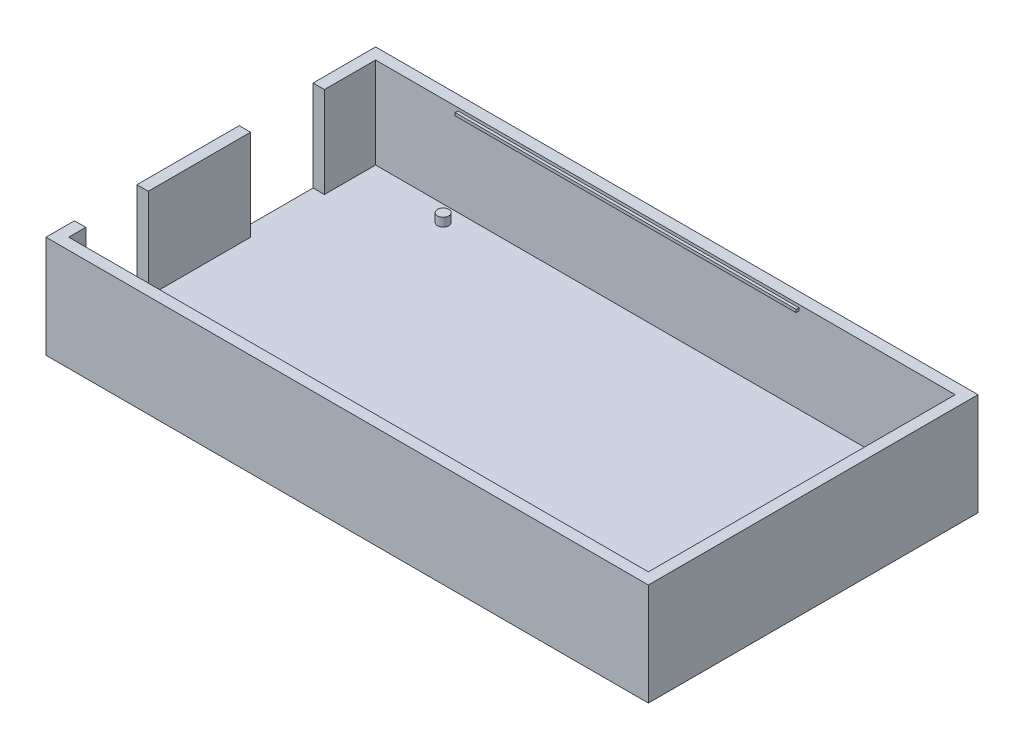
SolidWorks part; units mm, degrees
ref_plane "Alzado" through (0, 0, 0) normal (0, 0, 1) x (1, 0, 0)
ref_plane "Planta" through (0, 0, 0) normal (0, 1, 0) x (1, 0, 0)
ref_plane "Vista lateral" through (0, 0, 0) normal (1, 0, 0) x (0, 0, -1)
sketch "Croquis1" plane through (0, 0, 0) normal (0, 1, 0) x (1, 0, 0)
  line L1 (0, 0) -> (106, 0)
  line L2 (0, 0) -> (0, 58)
  line L3 (0, 58) -> (106, 58)
  line L4 (106, 0) -> (106, 58)
  dimension "D1" = 106
  dimension "D2" = 58
extrude "Saliente-Extruir1" add sketch "Croquis1" along normal blind 18
shell "Vaciado1" thickness 2
ref_plane "Plano1" through (0, 2, 0) normal (0, 1, 0) x (1, 0, 0)
ref_plane "Plano6" through (0, 0, 0) normal (-1, 0, 0) x (0, 0, 1)
sketch "Croquis9" plane through (0, 0, 0) normal (-1, 0, 0) x (0, 0, 1)
  line L0 (-47, 18) -> (-47, 2)
  line L1 (-58, 18) -> (0, 18) construction
  line L2 (29.7, 2) -> (-29.7, 2) construction
  line L3 (-47, 2) -> (-34, 2)
  line L4 (-34, 2) -> (-34, 18)
  line L5 (-34, 18) -> (-47, 18)
  line L6 (-16, 18) -> (-16, 2)
  line L7 (-16, 2) -> (-5, 2)
  line L8 (-5, 2) -> (-5, 18)
  line L9 (-5, 18) -> (-16, 18)
  dimension "D1" = 13
  dimension "D2" = 11
  dimension "D3" = 18
  dimension "D4" = 11
extrude "Cortar-Extruir1" cut sketch "Croquis9" against normal up to next
ref_plane "Plano7" through (0, 0, -56) normal (0, 0, 1) x (1, 0, 0)
sketch "Croquis10" plane through (0, 0, -56) normal (0, 0, 1) x (1, 0, 0)
  line L0 (104, 18) -> (104, 2) construction
  line L1 (16.5, 17.5) -> (76.5, 17.5)
  line L2 (16.5, 17.5) -> (16.5, 17)
  line L3 (16.5, 17) -> (76.5, 17)
  line L4 (76.5, 17.5) -> (76.5, 17)
  line L5 (104, 18) -> (2, 18) construction
  dimension "D1" = 60
  dimension "D2" = 0.5
  dimension "D3" = 27.5
  dimension "D4" = 0.5
extrude "Saliente-Extruir10" add sketch "Croquis10" along normal blind 0.5
ref_plane "Plano8" through (0, 0, -2) normal (0, 0, -1) x (-1, 0, 0)
sketch "Croquis11" plane through (0, 0, -2) normal (0, 0, -1) x (-1, 0, 0)
  line L0 (-2, 18) -> (-104, 18) construction
  line L1 (-89.5, 17.5) -> (-29.5, 17.5)
  line L2 (-89.5, 17.5) -> (-89.5, 17)
  line L3 (-89.5, 17) -> (-29.5, 17)
  line L4 (-29.5, 17.5) -> (-29.5, 17)
  line L6 (-2, 18) -> (-2, 2) construction
  dimension "D1" = 60
  dimension "D2" = 0.5
  dimension "D3" = 0.5
  dimension "D4" = 27.5
extrude "Saliente-Extruir11" add sketch "Croquis11" along normal blind 0.5
ref_plane "Plano10" through (0, 2, 0) normal (0, 1, 0) x (1, 0, 0)
sketch "Croquis14" plane through (0, 2, 0) normal (0, 1, 0) x (1, 0, 0)
  circle A0 centre (16.6999, 53.1876) radius 1
  circle A1 centre (91.6299, 53.1876) radius 1
  circle A2 centre (97.9799, 4.9276) radius 1
  circle A3 centre (15.4299, 4.9276) radius 1
  dimension "D1" = 2
  dimension "D2" = 2
  dimension "D3" = 2
  dimension "D4" = 2
extrude "Saliente-Extruir12" add sketch "Croquis14" along normal blind 1.5
